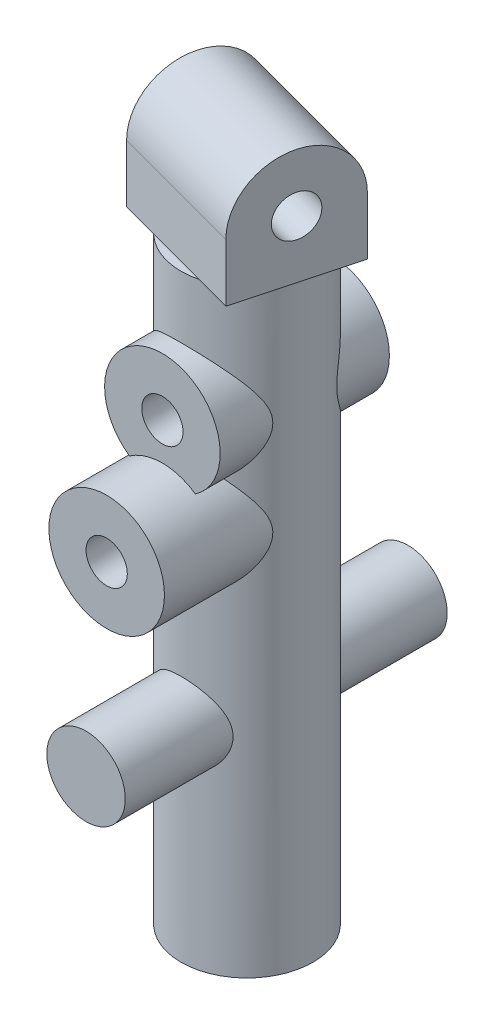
SolidWorks part; units mm, degrees
ref_plane "Face" through (0, 0, 0) normal (0, 0, 1) x (1, 0, 0)
ref_plane "Dessus" through (0, 0, 0) normal (0, 1, 0) x (1, 0, 0)
ref_plane "Droite" through (0, 0, 0) normal (1, 0, 0) x (0, 0, -1)
sketch "Esquisse1" plane through (0, 0, 0) normal (0, 1, 0) x (1, 0, 0)
  circle A0 centre (0, 0) radius 1.6
  circle A1 centre (0, 0) radius 0.6 construction
  dimension "D1" = 3.2
  dimension "D2" = 1.2
extrude "Extrusion1" add sketch "Esquisse1" along normal blind 14.5
sketch "Esquisse2" plane through (0, 0, 0) normal (0, 0, 1) x (1, 0, 0)
  line L0 (-1.6, 0) -> (1.6, 0) construction
  circle A0 centre (0, 5.05) radius 0.95
  dimension "D1" = 1.9
  dimension "D2" = 5.05
extrude "Extrusion2" add sketch "Esquisse2" along normal mid plane 7.8
sketch "Esquisse3" plane through (0, 0, 0) normal (0, 0, 1) x (1, 0, 0)
  line L0 (-1.6, 0) -> (1.6, 0) construction
  line L1 (0, 0) -> (0, 9.3) construction
  circle A0 centre (0, 9.3) radius 1.4
  dimension "D1" = 2.8
  dimension "D2" = 9.3
extrude "Extrusion3" add sketch "Esquisse3" along normal blind 3.4
sketch "Esquisse4" plane through (0, 0, 0) normal (0, 0, 1) x (1, 0, 0)
  line L0 (-1.6, 0) -> (1.6, 0) construction
  circle A0 centre (0, 11.6) radius 1.4
  dimension "D1" = 2.8
  dimension "D2" = 11.6
extrude "Extrusion4" add sketch "Esquisse4" along normal mid plane 4.1
sketch "Esquisse5" plane through (0, 0, 0) normal (1, 0, 0) x (0, 0, -1)
  line L0 (1.6, 14.5) -> (-1.6, 14.5) construction
  line L1 (0, 0) -> (0, 15.9) construction
  line L2 (-1.4, 15.9) -> (-1.4, 14.5)
  line L3 (-1.4, 14.5) -> (1.4, 14.5)
  line L4 (1.4, 14.5) -> (1.4, 15.9)
  line L5 (-1.6, 0) -> (1.6, 0) construction
  arc A0 (1.4, 15.9) -> (-1.4, 15.9) centre (0, 15.9) ccw
  circle A1 centre (0, 15.9) radius 0.5
  dimension "D1" = 1
  dimension "D2" = 2.8
  dimension "D3" = 15.9
extrude "Extrusion5" add sketch "Esquisse5" along normal mid plane 3.4 separate body
move or copy body "Corps-Déplacer/Copier1" bodies to move or copy 105
sketch "Esquisse7" plane through (0, 0, 0) normal (0, -1, 0) x (1, 0, 0)
  circle A0 centre (0, 0) radius 0.6
  dimension "D1" = 1.2
extrude "Extrusion6" cut sketch "Esquisse7" against normal blind 13
sketch "Esquisse8" plane through (0, 0, 3.4) normal (0, 0, 1) x (1, 0, 0)
  circle A0 centre (0, 9.3) radius 0.5
  dimension "D1" = 1
extrude "Extrusion7" cut sketch "Esquisse8" against normal up to next
sketch "Esquisse10" plane through (0, 0, 2.05) normal (0, 0, 1) x (1, 0, 0)
  circle A0 centre (0, 11.6) radius 0.5
  dimension "D1" = 1
extrude "Extrusion8" cut sketch "Esquisse10" against normal through all
